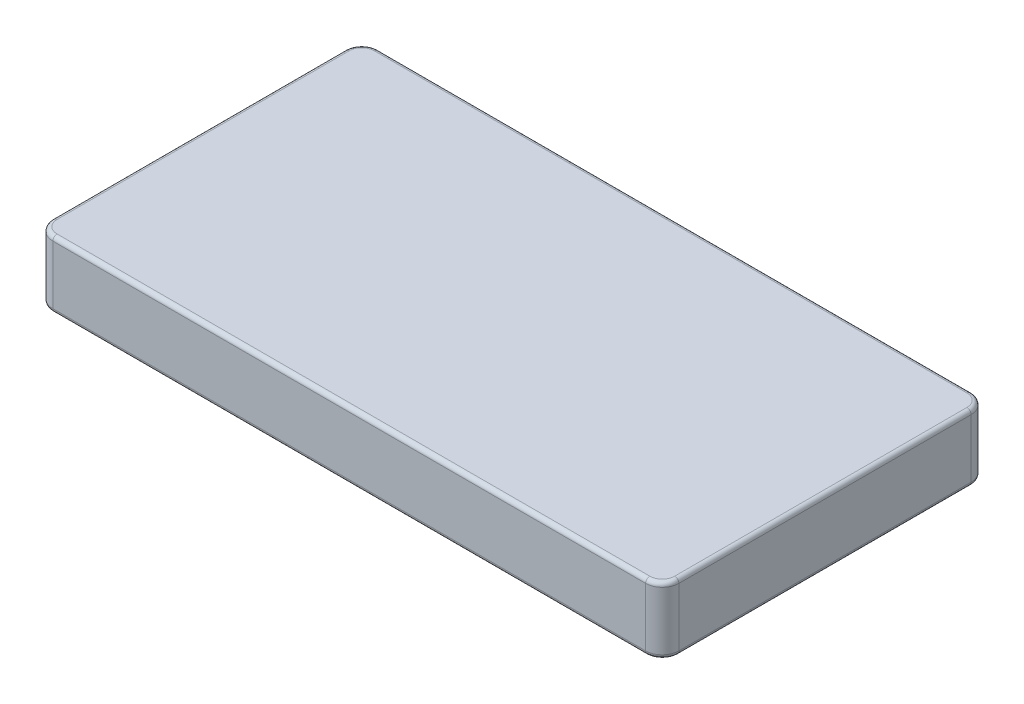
SolidWorks part; units mm, degrees
ref_plane "Front Plane" through (0, 0, 0) normal (0, 0, 1) x (1, 0, 0)
ref_plane "Top Plane" through (0, 0, 0) normal (0, 1, 0) x (1, 0, 0)
ref_plane "Right Plane" through (0, 0, 0) normal (1, 0, 0) x (0, 0, -1)
sketch "Sketch1" plane through (0, 0, 0) normal (0, 1, 0) x (1, 0, 0)
  line L1 (-901.7, -495.3) -> (901.7, -495.3)
  line L2 (-952.5, -444.5) -> (-952.5, 444.5)
  line L3 (-901.7, 495.3) -> (901.7, 495.3)
  line L4 (952.5, -444.5) -> (952.5, 444.5)
  line L5 (-952.5, -495.3) -> (952.5, 495.3) construction
  line L6 (-952.5, 495.3) -> (952.5, -495.3) construction
  arc A0 (901.7, 495.3) -> (952.5, 444.5) centre (901.7, 444.5) cw
  arc A1 (952.5, -444.5) -> (901.7, -495.3) centre (901.7, -444.5) cw
  arc A2 (-901.7, -495.3) -> (-952.5, -444.5) centre (-901.7, -444.5) cw
  arc A3 (-901.7, 495.3) -> (-952.5, 444.5) centre (-901.7, 444.5) ccw
  point P0 (0, 0)
  dimension "D3" = 50.8
  dimension "D1" = 1905
  dimension "D2" = 990.6
extrude "Boss-Extrude1" add sketch "Sketch1" along normal blind 203.2
fillet "Fillet1" radius 12.7 16 edges at (937.621, 0, 480.421) (952.5, 0, 0) (937.621, 0, -480.421) (0, 0, -495.3) (-937.621, 0, -480.421) (-952.5, 0, 0) (-937.621, 0, 480.421) (0, 0, 495.3) (937.621, 203.2, 480.421) (952.5, 203.2, 0) (937.621, 203.2, -480.421) (0, 203.2, -495.3) (-937.621, 203.2, -480.421) (-952.5, 203.2, 0) (-937.621, 203.2, 480.421) (0, 203.2, 495.3)
